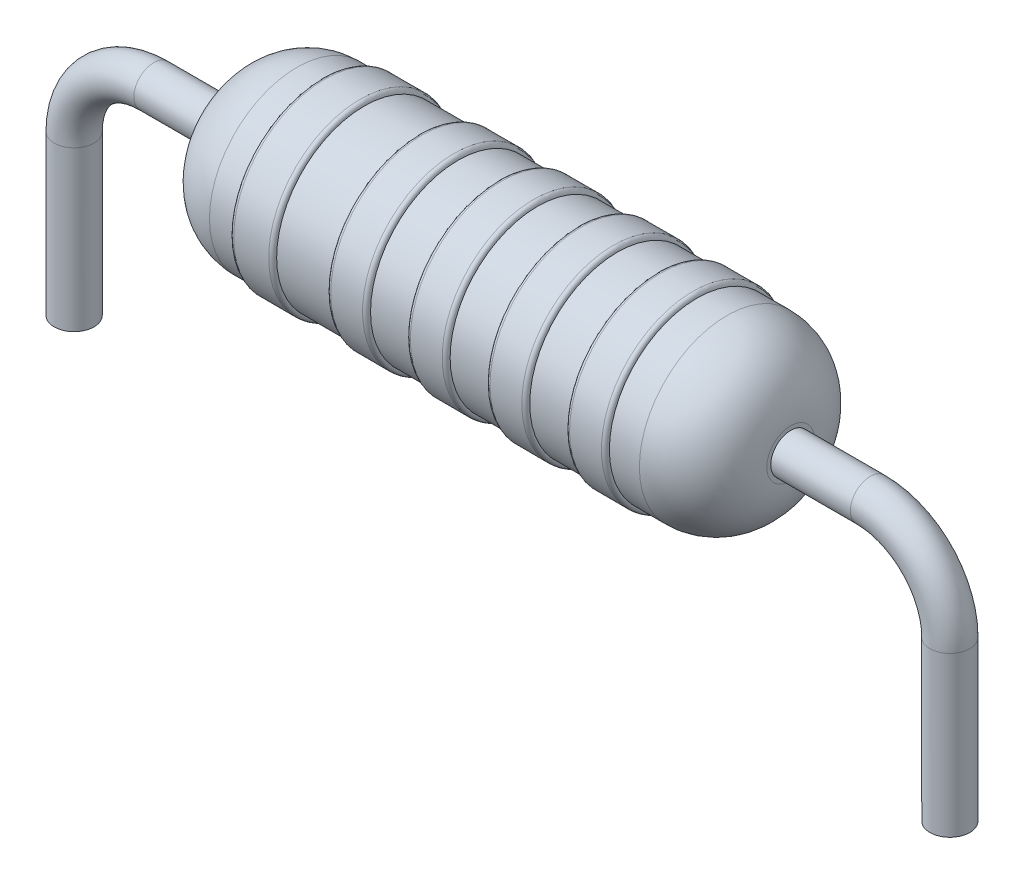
SolidWorks part; units mm, degrees
ref_plane "Face" through (0, 0, 0) normal (0, 0, 1) x (1, 0, 0)
ref_plane "Dessus" through (0, 0, 0) normal (0, 1, 0) x (1, 0, 0)
ref_plane "Droite" through (0, 0, 0) normal (1, 0, 0) x (0, 0, -1)
sketch "Esquisse1" plane through (0, 0, 0) normal (0, 0, 1) x (1, 0, 0)
  line L0 (-54.2687, 0) -> (62.1733, 0) construction
  line L1 (-48.4922, 1.1) -> (45.7559, 1.1) construction
  line L2 (-3.5, -1.6411) -> (-3.5, 4.3175) construction
  line L3 (0, -1.0268) -> (0, 4.1947) construction
  line L4 (3.5, 3.6009) -> (3.5, -1.9687) construction
  line L5 (-3.5, 0) -> (-3.5, 0.3)
  line L6 (-2.7, 1.1) -> (2.7, 1.1)
  line L7 (3.5, 0.3) -> (3.5, 0)
  line L8 (3.5, 0) -> (-3.5, 0)
  arc A0 (-2.7, 1.1) -> (-3.5, 0.3) centre (-2.7, 0.3) ccw
  arc A1 (3.5, 0.3) -> (2.7, 1.1) centre (2.7, 0.3) ccw
revolve "Base-Révolution" add sketch "Esquisse1" angle 360 about L0
sketch "Esquisse2" plane through (0, 0, 0) normal (0, 0, 1) x (1, 0, 0)
  line L0 (-3.3896, 1.15) -> (3.161, 1.15) construction
  line L1 (-2.3956, 1.3889) -> (-2.3956, -0.1179) construction
  line L2 (-1.8562, 1.4925) -> (-1.8562, -0.2136) construction
  line L3 (4.3262, 0) -> (-3.8651, 0) construction
  line L4 (0.823, 0) -> (1.323, 0)
  line L5 (-0.177, 0) -> (0.323, 0)
  line L6 (-1.177, 1.15) -> (-1.177, 0)
  line L7 (-0.177, 1.15) -> (-0.177, 0)
  line L8 (0.823, 1.15) -> (0.823, 0)
  line L9 (-0.677, 1.15) -> (-0.677, 0)
  line L10 (0.323, 1.15) -> (0.323, 0)
  line L11 (1.323, 1.15) -> (1.323, 0)
  line L12 (-1.177, 0) -> (-0.677, 0)
  line L13 (-1.177, 1.15) -> (-0.677, 1.15)
  line L14 (-0.177, 1.15) -> (0.323, 1.15)
  line L15 (0.823, 1.15) -> (1.323, 1.15)
  line L16 (-1.8562, 1.15) -> (-2.3956, 1.15)
  line L17 (-2.3956, 1.15) -> (-2.3956, 0)
  line L18 (-2.3956, 0) -> (-1.8562, 0)
  line L19 (-1.8562, 0) -> (-1.8562, 1.15)
  line L20 (1.823, 0) -> (2.323, 0)
  line L21 (1.823, 1.15) -> (1.823, 0)
  line L22 (2.323, 1.15) -> (2.323, 0)
  line L23 (1.823, 1.15) -> (2.323, 1.15)
  dimension "D1" = 2
revolve "Boss.-Révol.1" add sketch "Esquisse2" angle 360 about L3
sketch "Esquisse3" plane through (-3.5, 0, 0) normal (-1, 0, 0) x (0, 0, 1)
  circle A0 centre (0, 0) radius 0.25
sketch "Esquisse4" plane through (0, 0, 0) normal (0, 0, 1) x (1, 0, 0)
  line L0 (-3.1075, 0) -> (-5.8186, 0) construction
  line L1 (0, -2.524) -> (0, 3.2043) construction
  line L2 (-5.9326, -3) -> (3.6667, -3) construction
  line L3 (-5.5, 1.6795) -> (-5.5, -3.4934) construction
  line L4 (-3.5, 0) -> (-4.5, 0)
  line L5 (-5.5, -1) -> (-5.5, -3)
  arc A0 (-4.5, 0) -> (-5.5, -1) centre (-4.5, -1) ccw
  dimension "D3" = 1
  dimension "D1" = 3
  dimension "D2" = 5.5
sweep "Balayage1" add profiles "Esquisse3" path "Esquisse4"
ref_plane "Plan1" through (0, 0, 0) normal (1, 0, 0) x (0, 0, -1)
mirror "Symétrie1" about plane through (0, 0, 0) normal (1, 0, 0) of "Balayage1"
fillet "Congé1" radius 0.05 10 edges at (-2.3956, 0, -1.15) (-1.8562, 0, -1.15) (-1.177, 0, -1.15) (-0.677, 0, -1.15) (-0.177, 0, -1.15) (0.323, 0, -1.15) (0.823, 0, -1.15) (1.323, 0, -1.15) (1.823, 0, -1.15) (2.323, 0, -1.15)
